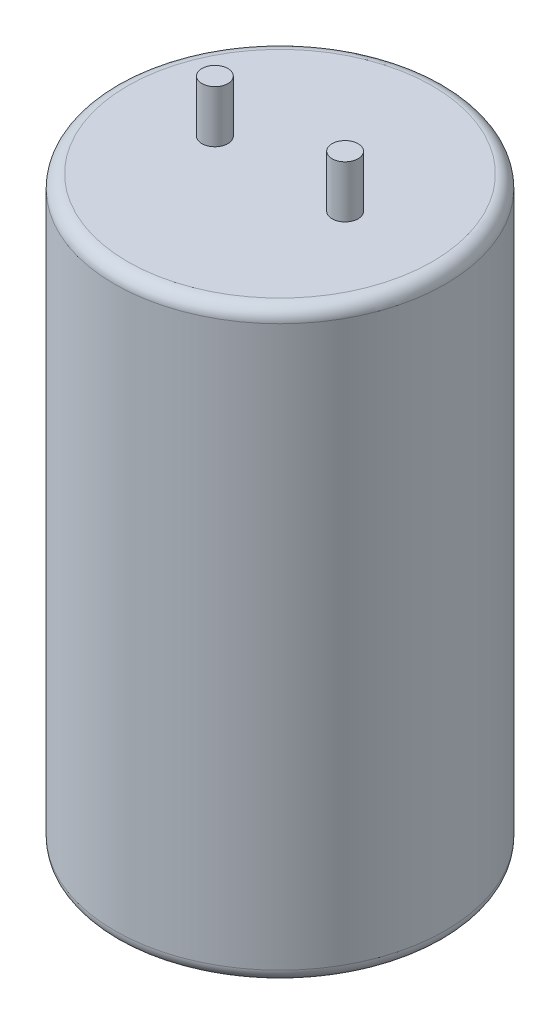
SolidWorks part; units mm, degrees
ref_plane "Plano frontal" through (0, 0, 0) normal (0, 0, 1) x (1, 0, 0)
ref_plane "Plano superior" through (0, 0, 0) normal (0, 1, 0) x (1, 0, 0)
ref_plane "Plano direito" through (0, 0, 0) normal (1, 0, 0) x (0, 0, -1)
sketch "Esboço1" plane through (0, 0, 0) normal (0, 1, 0) x (1, 0, 0)
  circle A0 centre (0, 0) radius 12.7
  dimension "D1" = 25.4
extrude "Ressalto-extrusão1" add sketch "Esboço1" along normal blind 45
fillet "Filete1" radius 1 2 edges at (0, 0, 12.7) (0, 45, 12.7)
sketch "Esboço2" plane through (0, 45, 0) normal (0, 1, 0) x (1, 0, 0)
  line L0 (-11.7, 0) -> (11.7, 0) construction
  circle A0 centre (0, 0) radius 11.7 construction
  circle A1 centre (5, 0) radius 1
  circle A2 centre (-5, 0) radius 1
  point P5 (-5, 0)
  point P6 (5, 0)
  dimension "D3" = 2
  dimension "D4" = 2
  dimension "D1" = 5
  dimension "D2" = 5
extrude "Ressalto-extrusão2" add sketch "Esboço2" along normal blind 4
